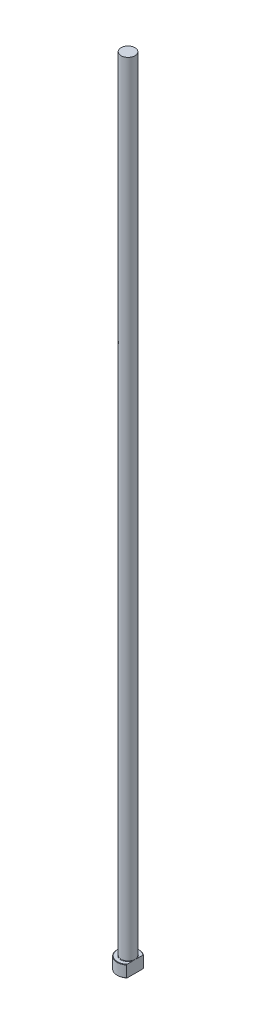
SolidWorks part; units mm, degrees
ref_plane "Front Plane" through (0, 0, 0) normal (0, 0, 1) x (1, 0, 0)
ref_plane "Top Plane" through (0, 0, 0) normal (0, 1, 0) x (1, 0, 0)
ref_plane "Right Plane" through (0, 0, 0) normal (1, 0, 0) x (0, 0, -1)
sketch "Sketch1" plane through (0, 0, 0) normal (0, 0, 1) x (1, 0, 0)
  line L0 (0, 259.9588) -> (0, -15.1925) construction
  line L1 (0, 0) -> (-5.5, 0)
  line L2 (-5.5, 0) -> (-5.5, 6)
  line L3 (-5.5, 6) -> (-3.5, 6)
  line L4 (-3.5, 6) -> (-3.5, 400)
  line L5 (-3.5, 400) -> (0, 400)
  line L6 (0, 400) -> (0, 0)
  dimension "L" = 400
  dimension "H" = 11
  dimension "T" = 6
  dimension "D" = 7
revolve "Revolve1" add sketch "Sketch1" angle 360 about L0
chamfer "Chamfer1" distance 0.2 angle 45 2 edges at (0, 6, 5.5) (0, 0, 5.5)
fillet "Fillet1" radius 0.2 1 edges at (0, 6, 3.5)
sketch "Sketch2" plane through (0, 0, 0) normal (0, 1, 0) x (1, 0, 0)
  line L0 (3.5, -4.2426) -> (3.5, 4.2426)
  circle A0 centre (0, 0) radius 5.5 construction
  arc A1 (3.5, -4.2426) -> (3.5, 4.2426) centre (0, 0) ccw
  circle A2 centre (0, 0) radius 3.5 construction
extrude "KEYED HEAD" cut sketch "Sketch2" along normal through all
